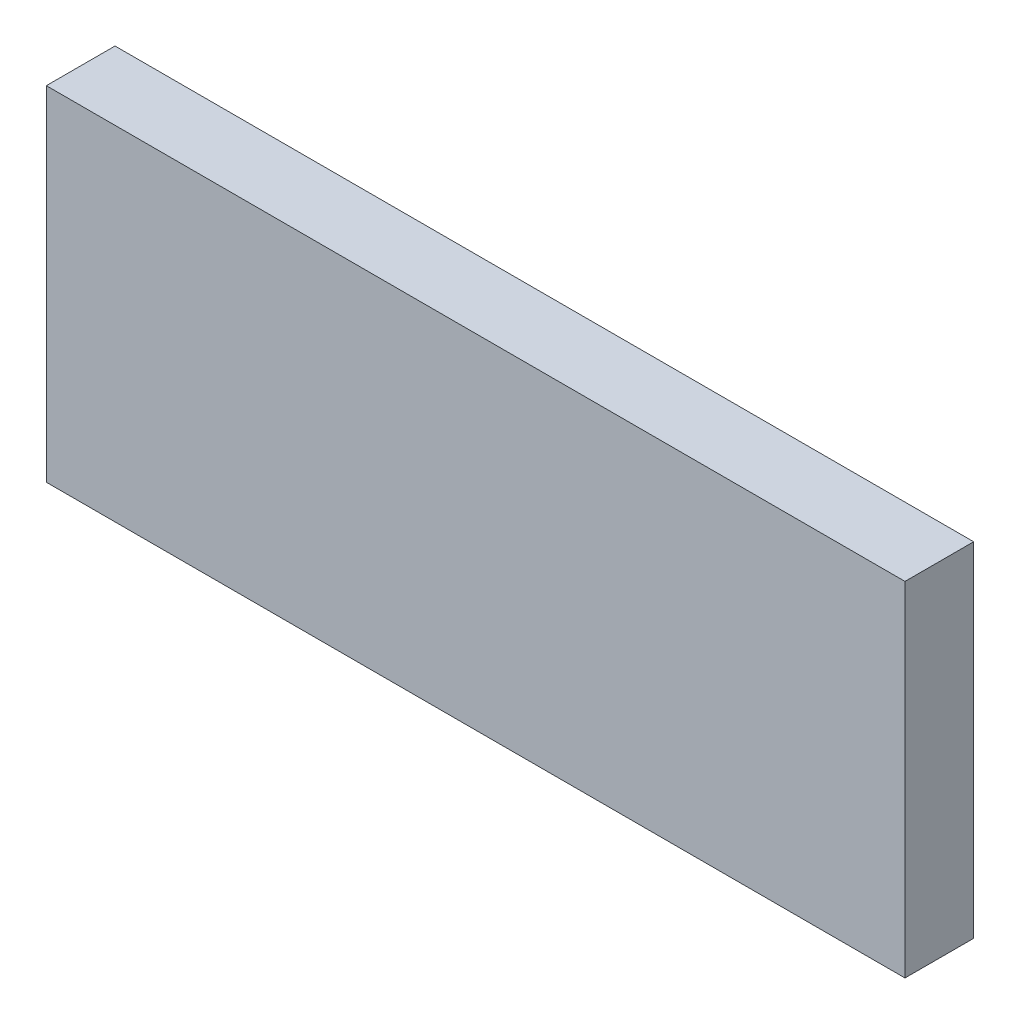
SolidWorks part; units mm, degrees
ref_plane "前视基准面" through (0, 0, 0) normal (0, 0, 1) x (1, 0, 0)
ref_plane "上视基准面" through (0, 0, 0) normal (0, 1, 0) x (1, 0, 0)
ref_plane "右视基准面" through (0, 0, 0) normal (1, 0, 0) x (0, 0, -1)
sketch "草图1" plane through (0, 0, 0) normal (0, 0, 1) x (1, 0, 0)
  line L1 (0, 0) -> (100, 0)
  line L2 (0, 0) -> (0, 40)
  line L3 (0, 40) -> (100, 40)
  line L4 (100, 0) -> (100, 40)
  dimension "D1" = 40
  dimension "D2" = 100
extrude "拉伸1" add sketch "草图1" along normal blind 8
